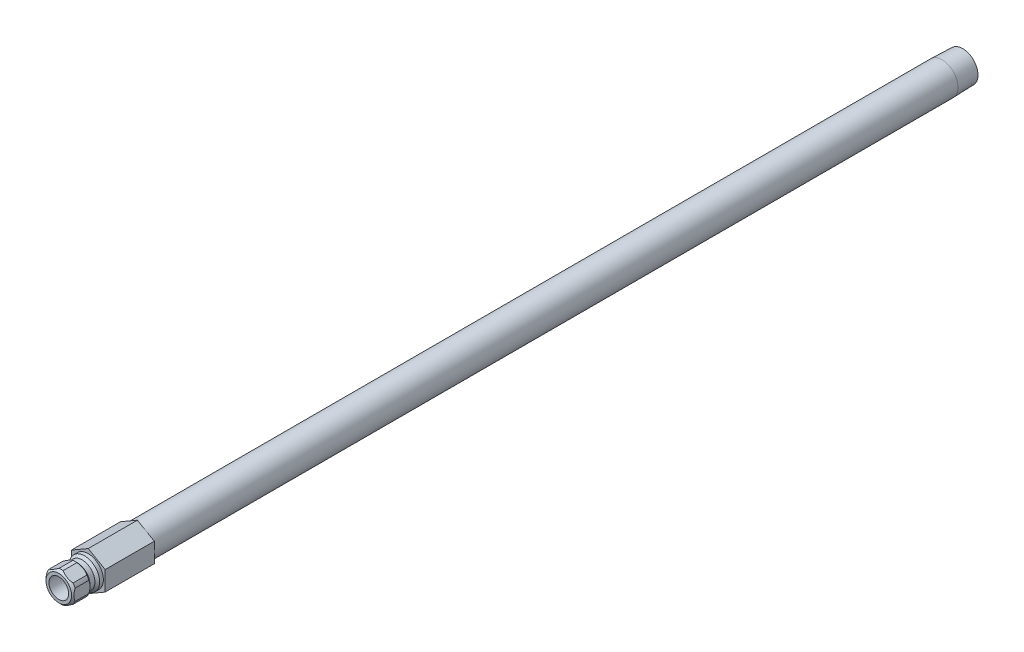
SolidWorks part; units mm, degrees
ref_plane "Front Plane" through (0, 0, 0) normal (0, 0, 1) x (1, 0, 0)
ref_plane "Top Plane" through (0, 0, 0) normal (0, 1, 0) x (1, 0, 0)
ref_plane "Right Plane" through (0, 0, 0) normal (1, 0, 0) x (0, 0, -1)
sketch "Sketch1" plane through (0, 0, 0) normal (1, 0, 0) x (0, 0, -1)
  line L0 (0, 0) -> (-12.7, 0) construction
  line L1 (-9.525, 3.175) -> (-9.525, 4.1275)
  line L2 (-3.556, 4.1275) -> (-3.556, 0) construction
  line L3 (-8.763, 4.8895) -> (-4.318, 4.8895)
  line L4 (0, 5.1435) -> (0, 3.4163) construction
  line L5 (-3.556, 4.1275) -> (-1.9685, 4.1275)
  line L6 (-1.2065, 4.8895) -> (0, 4.8895)
  line L7 (0, 4.8895) -> (0, 5.1435)
  line L8 (-3.556, 4.1275) -> (-4.318, 4.8895)
  line L9 (-1.9685, 4.1275) -> (-1.2065, 4.8895)
  line L10 (-9.525, 4.1275) -> (-8.763, 4.8895)
  line L12 (0, 5.1435) -> (275.8948, 5.1435)
  line L13 (275.8948, 5.1435) -> (282.575, 4.9347)
  line L14 (282.575, 4.9347) -> (282.575, 2.3813)
  line L15 (0, 0) -> (15.875, 0) construction
  line L16 (15.875, 0) -> (15.875, 4.8895) construction
  line L17 (15.875, 4.8895) -> (0, 4.8895) construction
  line L18 (0.127, 2.3813) -> (282.575, 2.3813)
  line L19 (0.127, 3.175) -> (-9.525, 3.175)
  line L20 (0, 3.175) -> (0, 0) construction
  line L21 (0.127, 2.3813) -> (0.127, 3.175)
  dimension "D1" = 9.525
  dimension "D2" = 1.5875
  dimension "D3" = 0.762
  dimension "D4" = 45
  dimension "D5" = 5.969
  dimension "D6" = 45
  dimension "D7" = 1.79
  dimension "D8" = 6.6802
  dimension "D9" = 292.1
  dimension "D10" = 3.175
  dimension "D11" = 25.4
  dimension "D12" = 4.7625
  dimension "D13" = 6.35
  dimension "D14" = 9.779
  dimension "D15" = 10.287
  dimension "D16" = 9.652
revolve "Revolve1" add sketch "Sketch1" angle 360 about L0
sketch "Sketch2" plane through (0, 0, 0) normal (0, 0, 1) x (1, 0, 0)
  line L1 (-5.461, 3.1529) -> (-5.461, -3.1529)
  line L2 (-5.461, -3.1529) -> (0, -6.3058)
  line L3 (0, -6.3058) -> (5.461, -3.1529)
  line L4 (5.461, -3.1529) -> (5.461, 3.1529)
  line L5 (5.461, 3.1529) -> (0, 6.3058)
  line L6 (0, 6.3058) -> (-5.461, 3.1529)
  circle A0 centre (0, 0) radius 5.461 construction
  circle A1 centre (0, 0) radius 2.3812 construction
  circle A2 centre (0, 0) radius 2.3812
  dimension "D1" = 10.922
extrude "Boss-Extrude1" add sketch "Sketch2" against normal up to vertex (15.875 mm away) from vertex at 0
sketch "Sketch3" plane through (0, 0, 0) normal (0, 0, 1) x (1, 0, 0)
  line L1 (-4.5212, -2.6103) -> (0, -5.2206)
  line L2 (0, -5.2206) -> (4.5212, -2.6103)
  line L3 (4.5212, -2.6103) -> (4.5212, 2.6103)
  line L4 (4.5212, 2.6103) -> (0, 5.2206)
  line L5 (0, 5.2206) -> (-4.5212, 2.6103)
  line L6 (-4.5212, 2.6103) -> (-4.5212, -2.6103)
  circle A0 centre (0, 0) radius 4.5212 construction
  dimension "D1" = 9.0424
extrude "Cut-Extrude1" cut sketch "Sketch3" along normal through all from vertex at 3.556 flip side to cut
